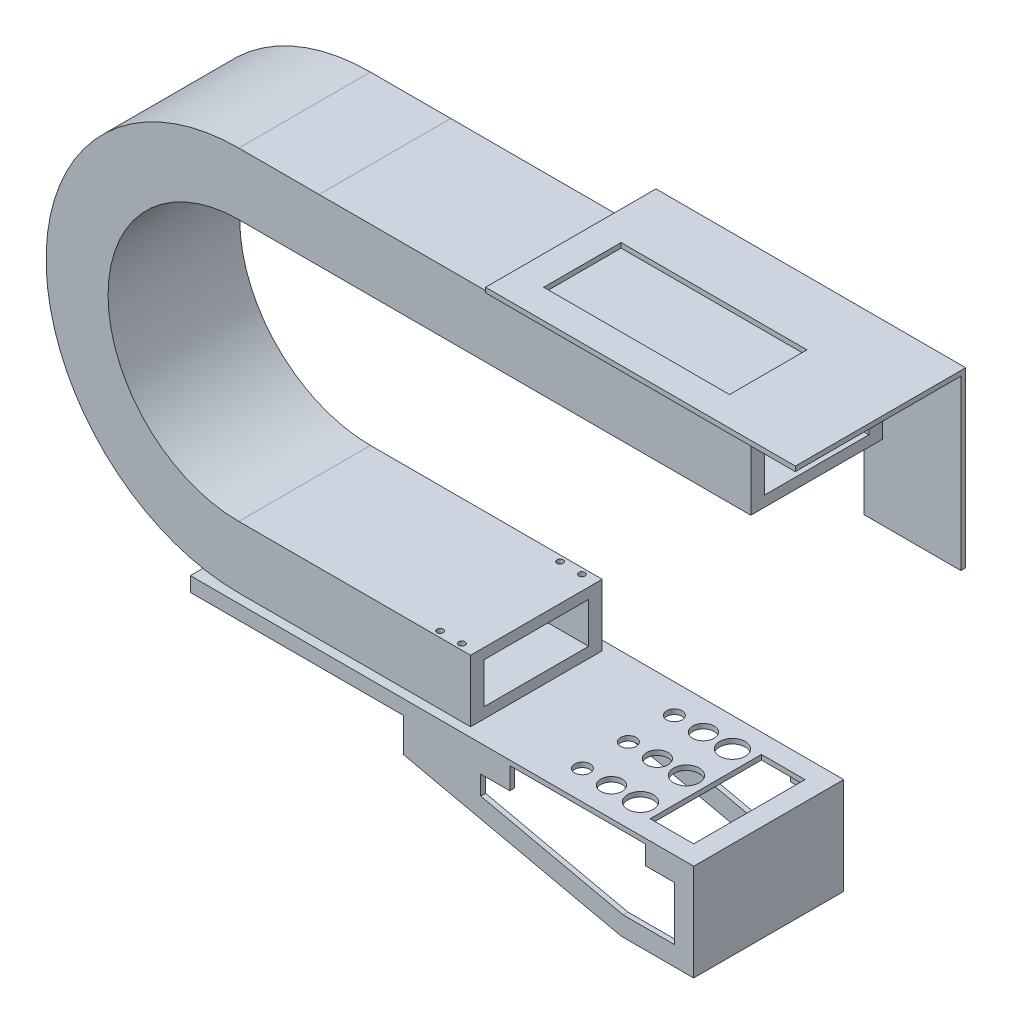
SolidWorks part; units mm, degrees
ref_plane "Vorne" through (0, 0, 0) normal (0, 0, 1) x (1, 0, 0)
ref_plane "Oben" through (0, 0, 0) normal (0, 1, 0) x (1, 0, 0)
ref_plane "Rechts" through (0, 0, 0) normal (1, 0, 0) x (0, 0, -1)
sketch "Verlauf" plane through (0, 0, 0) normal (0, 0, 1) x (1, 0, 0)
  line L0 (-528.9597, 0.02) -> (-446.0403, 0)
  line L1 (-529, -334) -> (-446, -334)
  line L2 (-446, 0) -> (0, 0)
  line L3 (-446, -334) -> (-289.51, -334)
  line L4 (-529, -166.99) -> (0, -166.99) construction
  line L5 (0, -166.99) -> (0, 0) construction
  arc A0 (-529, 0.02) -> (-529, -334) centre (-529, -166.99) ccw
  arc A1 (-528.9597, 0.02) -> (-529, 0.02) centre (-529, -166.99) ccw
  arc A2 (-446.0403, 0) -> (-446, 0) centre (-446, 167.01) ccw
  dimension "R__" = 167.01
  dimension "H__" = 334
  dimension "LG\\D-R__" = 83
  dimension "D-R\\A__" = 83
  dimension "Lo+D-R\\A__" = 529
  dimension "Lu+LG\\D-R__" = 239.49
sketch "Querschnitt" plane through (0, 0, 0) normal (1, 0, 0) x (0, 0, -1)
  line L0 (68, 32) -> (-68, -32) construction
  line L1 (-68, 32) -> (68, 32)
  line L2 (-68, 32) -> (-68, -32)
  line L3 (-68, -32) -> (68, -32)
  line L4 (68, 32) -> (68, -32)
  line L5 (-54, 21) -> (54, -21) construction
  line L6 (-54, 21) -> (54, 21)
  line L7 (-54, 21) -> (-54, -21)
  line L8 (-54, -21) -> (54, -21)
  line L9 (54, 21) -> (54, -21)
  point P8 (0, 0)
  point P9 (0, 0)
  dimension "D1" = 136
  dimension "D2" = 64
  dimension "D3" = 108
  dimension "D4" = 42
sweep "Austragung1" add profiles "Querschnitt" path "Verlauf"
hole_wizard "Bohrung1" positions "Skizze3" profile "Skizze2" legacy
sketch "Skizze3" plane through (0, 32, 0) normal (0, 1, 0) x (-1, 0, 0)
  line L1 (37.5, -62) -> (15, -62) construction
  line L2 (37.5, -62) -> (37.5, 62) construction
  line L3 (37.5, 62) -> (15, 62) construction
  line L4 (15, -62) -> (15, 62) construction
  line L8 (0, -68) -> (0, 68) construction
  line L9 (37.5, 0) -> (15, 0) construction
  point P0 (37.5, -62)
  point P1 (15, -62)
  point P3 (15, 62)
  point P5 (37.5, 62)
  dimension "D1" = 15
  dimension "D2" = 22.5
  dimension "D3" = 124
sketch "Skizze2" plane through (-37.5, 32, -62) normal (1, 0, 0) x (0, 0, 1)
  line L0 (0, 0) -> (0, 334)
  line L1 (0, 334) -> (3.25, 334)
  line L2 (3.25, 334) -> (3.25, 0)
  line L3 (3.25, 0) -> (0, 0)
  line L4 (0, 110) -> (0, -10) construction
  dimension "Durchmesser" = 6.5
  dimension "Tiefe" = 334
hole_wizard "Bohrung2" positions "Skizze5" profile "Skizze4" legacy
sketch "Skizze5" plane through (0, -302, 0) normal (0, 1, 0) x (-1, 0, 0)
  line L1 (304.51, 62) -> (327.01, 62) construction
  line L2 (304.51, 62) -> (304.51, -62) construction
  line L3 (304.51, -62) -> (327.01, -62) construction
  line L4 (327.01, 62) -> (327.01, -62) construction
  line L5 (289.51, 68) -> (289.51, -68) construction
  line L8 (327.01, 0) -> (304.51, 0) construction
  line L9 (55, 0) -> (-55, 0) construction
  point P0 (304.51, 62)
  point P1 (327.01, 62)
  point P3 (327.01, -62)
  point P5 (304.51, -62)
  dimension "D1" = 15
  dimension "D2" = 22.5
  dimension "D3" = 124
sketch "Skizze4" plane through (-304.51, -302, 62) normal (1, 0, 0) x (0, 0, 1)
  line L0 (0, 0) -> (0, 64)
  line L1 (0, 64) -> (3.25, 64)
  line L2 (3.25, 64) -> (3.25, 0)
  line L3 (3.25, 0) -> (0, 0)
  line L4 (0, 110) -> (0, -10) construction
  dimension "Durchmesser" = 6.5
  dimension "Tiefe" = 64
sketch "Skizze6" plane through (0, 0, 0) normal (0, 0, 1) x (1, 0, 0)
  line L0 (-529, -366) -> (-289.51, -366) construction
  line L1 (-289.51, -366) -> (-289.51, -302) construction
  line L2 (-124.51, -466) -> (-49.51, -466)
  line L3 (-569.51, -366) -> (-49.51, -366)
  line L4 (-49.51, -466) -> (-49.51, -366)
  line L5 (-349.51, -416) -> (-124.51, -466)
  line L6 (-349.51, -381) -> (-349.51, -416)
  line L7 (-349.51, -381) -> (-569.51, -381)
  line L8 (-569.51, -381) -> (-569.51, -366)
  line L9 (-269.51, -413.2899) -> (-122.3146, -446)
  line L10 (-122.3146, -446) -> (-69.51, -446)
  line L11 (-69.51, -446) -> (-69.51, -390.5)
  line L12 (-69.51, -390.5) -> (-99.51, -390.5)
  line L13 (-99.51, -390.5) -> (-99.51, -371)
  line L14 (-99.51, -371) -> (-239.51, -371)
  line L15 (-239.51, -371) -> (-239.51, -393.5)
  line L16 (-239.51, -393.5) -> (-269.51, -393.5)
  line L17 (-269.51, -393.5) -> (-269.51, -413.2899)
  dimension "D1" = 50
  dimension "D2" = 300
  dimension "D3" = 100
  dimension "D4" = 60
  dimension "D5" = 75
  dimension "D6" = 15
  dimension "D7" = 220
  dimension "D8" = 20
  dimension "D9" = 20
  dimension "D10" = 20
  dimension "D11" = 24.5
  dimension "D12" = 50
  dimension "D13" = 5
  dimension "D14" = 140
  dimension "D15" = 27.5
  dimension "D16" = 80
extrude "Linear austragen1" add sketch "Skizze6" along normal mid plane 155
sketch "Skizze12" plane through (-569.51, 0, 0) normal (-1, 0, 0) x (0, 0, 1)
  line L0 (-77.5, -381) -> (-77.5, -416) construction
  line L1 (-72.5, -466) -> (72.5, -466)
  line L2 (-72.5, -466) -> (-72.5, -371)
  line L3 (-72.5, -371) -> (72.5, -371)
  line L4 (72.5, -466) -> (72.5, -371)
  line L6 (77.5, -381) -> (77.5, -416) construction
  line L7 (77.5, -466) -> (-77.5, -466) construction
  line L8 (77.5, -366) -> (-77.5, -366) construction
  dimension "D1" = 5
  dimension "D2" = 5
  dimension "D3" = 5
extrude "Schnitt-Linear austragen1" cut sketch "Skizze12" against normal offset from surface (515 mm away) 5
sketch "Skizze9" plane through (0, 0, 0) normal (1, 0, 0) x (0, 0, -1)
  line L1 (-70, 37) -> (106, 37)
  line L2 (-70, 37) -> (-70, 32)
  line L3 (-68, 32) -> (-68, -32) construction
  line L4 (68, 32) -> (-68, 32) construction
  line L9 (101, 32) -> (101, -142)
  line L10 (101, -142) -> (106, -142)
  line L11 (106, 37) -> (106, -142)
  line L12 (-70, 32) -> (101, 32)
  dimension "D1" = 176
  dimension "D2" = 5
  dimension "D3" = 179
  dimension "D4" = 2
extrude "Linear austragen2" add sketch "Skizze9" against normal blind 272 and the other way blind 48
hole_wizard "Bohrung3" positions "Skizze14" profile "Skizze13" legacy
sketch "Skizze14" plane through (584.9, 0, 0) normal (-1, 0, 0) x (0, 0, 1)
  line L1 (-50, -377) -> (50, -377) construction
  line L2 (-50, -377) -> (-50, -427) construction
  line L3 (-50, -427) -> (50, -427) construction
  line L4 (50, -377) -> (50, -427) construction
  line L6 (0, -377) -> (0, -427) construction
  line L7 (0, -272.25) -> (0, 272.25) construction
  line L8 (72.5, -452) -> (-72.5, -452) construction
  point P0 (50, -377)
  point P1 (-50, -377)
  point P3 (-50, -427)
  point P5 (50, -427)
  dimension "D1" = 100
  dimension "D2" = 50
  dimension "D3" = 25
sketch "Skizze13" plane through (584.9, -377, 50) normal (0, 1, 0) x (0, 0, 1)
  line L0 (0, 0) -> (0, 100)
  line L1 (0, 100) -> (3.5, 100)
  line L2 (3.5, 100) -> (3.5, 0)
  line L3 (3.5, 0) -> (0, 0)
  line L4 (0, 110) -> (0, -10) construction
  dimension "Durchmesser" = 7
  dimension "Tiefe" = 100
sketch "Skizze15" plane through (0, 0, -106) normal (0, 0, -1) x (-1, 0, 0)
  line L0 (52, -142) -> (52, -41.9488)
  line L1 (272, -142) -> (-48, -142) construction
  line L2 (52, -41.9488) -> (272, 17)
  line L3 (272, -142) -> (272, 37) construction
  line L4 (272, 17) -> (272, -142)
  line L5 (272, -142) -> (52, -142)
  line L6 (272, 37) -> (-48, 37) construction
  dimension "D1" = 220
  dimension "D2" = 20
  dimension "D3" = 75
extrude "Schnitt-Linear austragen2" cut sketch "Skizze15" against normal up to next
sketch "Skizze16" plane through (0, 37, 0) normal (0, 1, 0) x (1, 0, 0)
  line L0 (-272, -70) -> (48, -70) construction
  line L1 (-242, -40) -> (-50, -40)
  line L2 (-242, -40) -> (-242, 40)
  line L3 (-242, 40) -> (-50, 40)
  line L4 (-50, -40) -> (-50, 40)
  line L5 (-272, 106) -> (-272, -70) construction
  dimension "D1" = 30
  dimension "D2" = 30
  dimension "D3" = 80
  dimension "D4" = 192
extrude "Schnitt-Linear austragen3" cut sketch "Skizze16" against normal up to surface (5 mm away)
sketch "Skizze17" plane through (0, -366, 0) normal (0, 1, 0) x (1, 0, 0)
  line L0 (-49.51, -77.5) -> (-49.51, 77.5) construction
  line L1 (-69.51, 57.5) -> (-114.51, 57.5)
  line L2 (-69.51, 57.5) -> (-69.51, -57.5)
  line L3 (-69.51, -57.5) -> (-114.51, -57.5)
  line L4 (-114.51, 57.5) -> (-114.51, -57.5)
  line L5 (-49.51, 77.5) -> (-569.51, 77.5) construction
  line L6 (-49.51, -77.5) -> (-569.51, -77.5) construction
  line L7 (-134.51, 47.5) -> (-134.51, -47.5) construction
  line L8 (-69.51, 0) -> (-134.51, 0) construction
  line L9 (-134.51, 0) -> (-164.51, 0) construction
  line L10 (-164.51, 47.5) -> (-164.51, -47.5) construction
  line L11 (-134.51, -47.5) -> (-164.51, -47.5) construction
  line L12 (-164.51, -47.5) -> (-194.51, -47.5) construction
  line L13 (-194.51, -47.5) -> (-194.51, 47.5) construction
  line L14 (-194.51, 47.5) -> (-164.51, 47.5) construction
  line L15 (-569.51, -77.5) -> (-569.51, 77.5) construction
  line L16 (-544.51, 40) -> (-339.51, 40)
  line L17 (-544.51, 40) -> (-544.51, -40)
  line L18 (-544.51, -40) -> (-339.51, -40)
  line L19 (-339.51, 40) -> (-339.51, -40)
  line L20 (-339.51, 0) -> (-194.51, 0) construction
  circle A0 centre (-134.51, 0) radius 13.25
  circle A1 centre (-134.51, 47.5) radius 13.25
  circle A2 centre (-134.51, -47.5) radius 13.25
  circle A3 centre (-164.51, 0) radius 11.05
  circle A4 centre (-164.51, -47.5) radius 11.05
  circle A5 centre (-164.51, 47.5) radius 11.05
  circle A6 centre (-194.51, 47.5) radius 8.05
  circle A7 centre (-194.51, 0) radius 8.05
  circle A8 centre (-194.51, -47.5) radius 8.05
  point P22 (-164.51, 0)
  dimension "D5" = 85
  dimension "D6" = 26.5
  dimension "D8" = 22.1
  dimension "D11" = 16.1
  dimension "D1" = 20
  dimension "D2" = 45
  dimension "D3" = 20
  dimension "D4" = 20
  dimension "D7" = 95
  dimension "D9" = 30
  dimension "D10" = 30
  dimension "D12" = 25
  dimension "D13" = 290
  dimension "D14" = 80
extrude "Schnitt-Linear austragen4" cut sketch "Skizze17" against normal up to next
